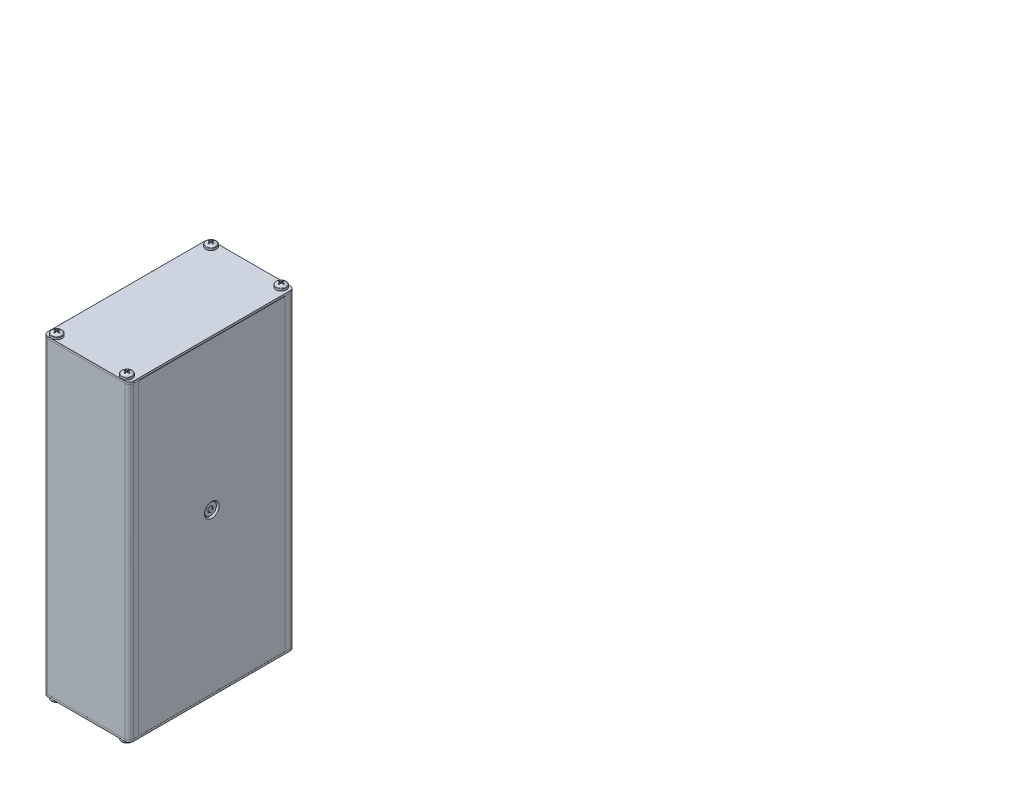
SolidWorks part; units mm, degrees
ref_plane "Front Plane" through (0, 0, 0) normal (0, 0, 1) x (1, 0, 0)
ref_plane "Top Plane" through (0, 0, 0) normal (0, 1, 0) x (1, 0, 0)
ref_plane "Right Plane" through (0, 0, 0) normal (1, 0, 0) x (0, 0, -1)
imported_body "Imported1"
imported_body "Surface-Imported1"
imported_body "Imported2"
imported_body "Imported3"
sketch "Sketch1" plane through (42.2275, 0, 0) normal (-1, 0, 0) x (0, 0, 1)
  line L0 (63.5058, 187.0761) -> (60.3308, 187.0761) construction
  line L1 (-63.5, 187.0761) -> (63.5, 187.0761)
  line L2 (-63.5, 187.0761) -> (-63.5, -52.9209)
  line L3 (-63.5, -52.9209) -> (63.5, -52.9209)
  line L4 (63.5, 187.0761) -> (63.5, -52.9209)
  line L5 (-63.5, 185.4886) -> (-63.5, -51.3334) construction
  line L6 (63.5, 185.4886) -> (63.5, -51.3334) construction
  line L7 (60.3308, -52.9209) -> (63.5058, -52.9209) construction
extrude "Cut-Extrude1" cut sketch "Sketch1" along normal blind 0.0025
delete or keep bodies "Body-Delete/Keep 1" type delete bodies bodies 105
